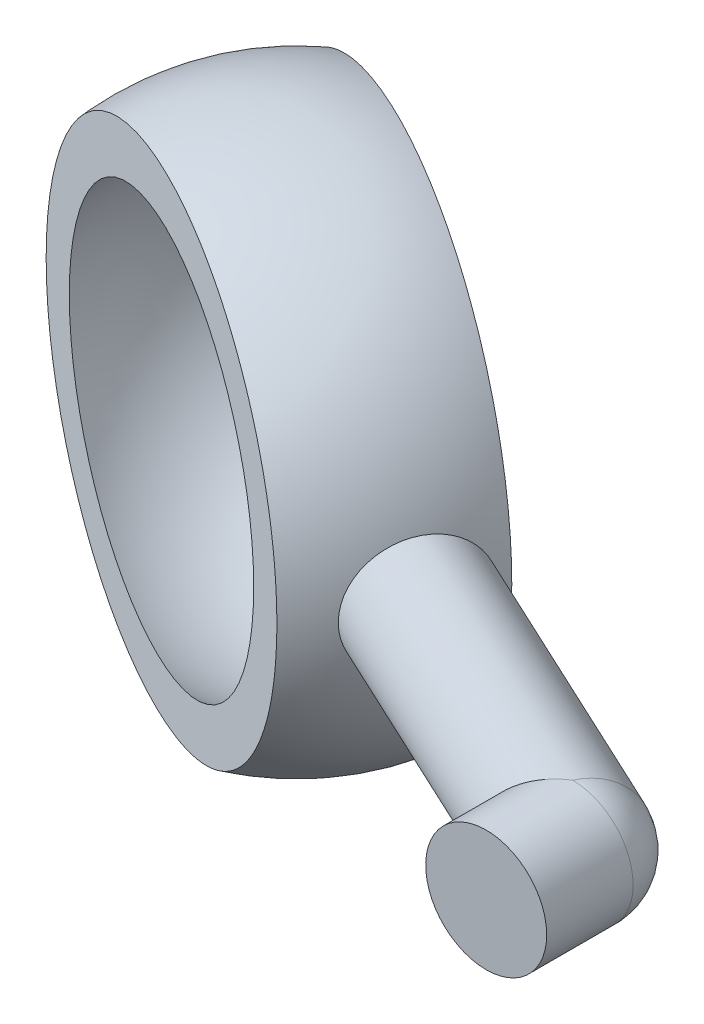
SolidWorks part; units mm, degrees
ref_plane "Face" through (0, 0, 0) normal (0, 0, 1) x (1, 0, 0)
ref_plane "Dessus" through (0, 0, 0) normal (0, 1, 0) x (1, 0, 0)
ref_plane "Droite" through (0, 0, 0) normal (1, 0, 0) x (0, 0, -1)
sketch "Esquisse10" plane through (0, 0, 0) normal (0, 0, 1) x (1, 0, 0)
  circle A0 centre (0, 0) radius 3.5
  dimension "D1" = 7
extrude "Extrusion3" add sketch "Esquisse10" along normal blind 5
sketch "Esquisse11" plane through (0, 0, 0) normal (0, 1, 0) x (1, 0, 0)
  line L0 (0, 0) -> (-7.9547, 3.7093) construction
  line L1 (3.5, 0) -> (-3.5, 0) construction
  line L2 (0, 0) -> (-1.4792, -3.1721)
  line L3 (-1.4792, -3.1721) -> (-31.3873, 10.7743)
  line L4 (-31.3873, 10.7743) -> (-29.9082, 13.9464)
  line L5 (-29.9082, 13.9464) -> (0, 0)
  dimension "D1" = 25
  dimension "D2" = 3.5
  dimension "D3" = 33
revolve "Révolution3" add sketch "Esquisse11" angle 360 about L0
sketch "Esquisse12" plane through (0, 0, 0) normal (0, 1, 0) x (1, 0, 0)
  line L0 (-29.9082, 32.7208) -> (-29.9082, -21.6308) construction
  line L4 (-28.429, 17.1185) -> (-31.3873, 10.7743) construction
  line L5 (-29.9082, 28.9464) -> (-29.9082, -1.0536)
  arc A0 (-29.9082, -1.0536) -> (-29.9082, 28.9464) centre (-29.9082, 13.9464) ccw
  dimension "D1" = 30
revolve "Révolution4" add sketch "Esquisse12" angle 360 about L0
sketch "Esquisse13" plane through (0, 0, 0) normal (0, 1, 0) x (1, 0, 0)
  line L0 (-29.9082, 28.625) -> (-29.9082, -6.4393) construction
  line L1 (-29.9082, 26.4464) -> (-29.9082, 1.4464)
  arc A0 (-29.9082, 1.4464) -> (-29.9082, 26.4464) centre (-29.9082, 13.9464) ccw
  arc A1 (-15.2096, 10.9542) -> (-18.168, 4.61) centre (-29.9082, 13.9464) ccw construction
  dimension "D1" = 25
revolve "Enlèvement de matière-Révolution4" cut sketch "Esquisse13" angle 360 about L0
sketch "Esquisse14" plane through (0, 0, 0) normal (0, 1, 0) x (1, 0, 0)
  line L0 (-1.9408, 5.4428) -> (-48.9615, 27.3689)
  line L1 (-6.167, -3.6203) -> (-53.1877, 18.3058)
  line L2 (-18.168, 4.61) -> (-3.5, -2.2297) construction
  arc A0 (-1.9408, 5.4428) -> (-48.9615, 27.3689) centre (-27.5643, 11.8743) ccw
  arc A1 (-53.1877, 18.3058) -> (-6.167, -3.6203) centre (-27.5643, 11.8743) ccw
  dimension "D1" = 5
  dimension "D2" = 5
extrude "Enlèv. mat.-Extru.4" cut sketch "Esquisse14" against normal blind 35 and the other way blind 45
sketch "Esquisse15" plane through (0, 0, 0) normal (0.9063, 0, 0.4226) x (0.4226, 0, -0.9063)
  line L0 (0, 12.8342) -> (0, -11.6548) construction
  line L1 (0, 3.5) -> (0, -3.5)
  line L2 (0, 3.5) -> (0, -3.5)
  arc A1 (0, -3.5) -> (0, 3.5) centre (0, 0) ccw
  arc A2 (0, -3.5) -> (0, 3.5) centre (0, 0) ccw
  dimension "D1" = 0
revolve "Révolution5" add sketch "Esquisse15" angle 360 about L0
